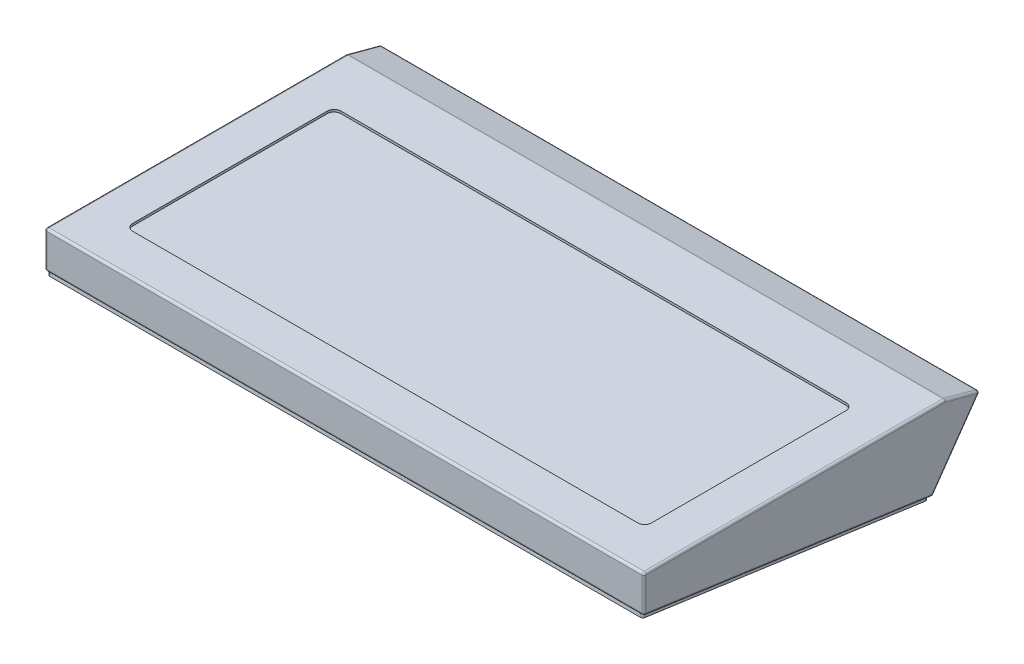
SolidWorks part; units mm, degrees
ref_plane "Front Plane" through (0, 0, 0) normal (0, 0, 1) x (1, 0, 0)
ref_plane "Top Plane" through (0, 0, 0) normal (0, 1, 0) x (1, 0, 0)
ref_plane "Right Plane" through (0, 0, 0) normal (1, 0, 0) x (0, 0, -1)
sketch "Sketch2" plane through (0, 0, 0) normal (1, 0, 0) x (0, 0, -1)
  line L1 (0, 0) -> (-209.55, 0)
  line L2 (-209.55, 0) -> (-209.55, -25.654)
  line L4 (-8.6004, -53.8956) -> (-209.55, -25.654)
  line L5 (0, 0) -> (24.5345, -6.574)
  line L6 (24.5345, -6.574) -> (-8.6004, -53.8956)
  dimension "D1" = 98
  dimension "D2" = 209.55
  dimension "D3" = 15
  dimension "D4" = 25.654
  dimension "D5" = 90
  dimension "D6" = 63
  dimension "D7" = 25.4
extrude "Enclosure Body" add sketch "Sketch2" along normal mid plane 416.56
fillet "Radii" radius 1.524 15 edges at (208.28, 0, 104.775) (0, 0, 209.55) (-208.28, 0, 104.775) (-208.28, -39.7748, 109.0752) (0, -25.654, 209.55) (208.28, -39.7748, 109.0752) (0, 0, 0) (208.28, -30.2348, -7.967) (208.28, -12.827, 209.55) (0, -6.574, -24.5345) (208.28, -3.287, -12.2673) (-208.28, -3.287, -12.2673) (-208.28, -12.827, 209.55) (0, -53.8956, 8.6004) (-208.28, -30.2348, -7.967)
sketch "Sketch3" plane through (0, 0, 0) normal (0, 1, 0) x (1, 0, 0)
  line L1 (-175.5648, -36.322) -> (175.5648, -36.322)
  line L2 (-180.34, -41.0972) -> (-180.34, -176.3268)
  line L3 (-175.5648, -181.102) -> (175.5648, -181.102)
  line L4 (180.34, -41.0972) -> (180.34, -176.3268)
  line L5 (206.756, -209.55) -> (-206.756, -209.55) construction
  arc A0 (-180.34, -176.3268) -> (-175.5648, -181.102) centre (-175.5648, -176.3268) ccw
  arc A1 (175.5648, -181.102) -> (180.34, -176.3268) centre (175.5648, -176.3268) ccw
  arc A2 (175.5648, -36.322) -> (180.34, -41.0972) centre (175.5648, -41.0972) cw
  arc A3 (-175.5648, -36.322) -> (-180.34, -41.0972) centre (-175.5648, -41.0972) ccw
  point P4 (0, -36.322)
  point P10 (-180.34, -181.102)
  point P13 (180.34, -181.102)
  point P18 (-180.34, -36.322)
  dimension "D4" = 4.7752
  dimension "D1" = 360.68
  dimension "D2" = 144.78
  dimension "D3" = 28.448
extrude "Keys Extrude" cut sketch "Sketch3" against normal blind 1.6002
sketch "Sketch4" plane through (0, -54.037, 7.5944) normal (0, -0.9903, 0.1392) x (1, 0, 0)
  line L7 (-205.232, 203.1087) -> (205.232, 203.1087)
  line L8 (206.756, 201.5847) -> (206.756, 4.4807)
  line L9 (205.232, 2.9567) -> (-205.232, 2.9567)
  line L10 (-206.756, 4.4807) -> (-206.756, 201.5847)
  line L11 (-208.28, 1.9498) -> (-208.28, 202.6155) construction
  line L12 (208.28, 202.6155) -> (208.28, 1.9498) construction
  line L13 (-206.756, 204.1247) -> (206.756, 204.1247) construction
  arc A4 (-206.756, 4.4807) -> (-205.232, 2.9567) centre (-205.232, 4.4807) ccw
  arc A5 (206.756, 4.4807) -> (205.232, 2.9567) centre (205.232, 4.4807) cw
  arc A6 (206.756, 201.5847) -> (205.232, 203.1087) centre (205.232, 201.5847) ccw
  arc A7 (-205.232, 203.1087) -> (-206.756, 201.5847) centre (-205.232, 201.5847) ccw
  dimension "D3" = 1.524
  dimension "D1" = 1.524
  dimension "D2" = 1.524
  dimension "D4" = 1.016
  dimension "D5" = 200.152
  dimension "D7" = 413.512
extrude "Sub-panel Emboss" add sketch "Sketch4" along normal blind 2.286
sketch "Sketch11" plane through (0, -56.3008, 7.9126) normal (0, -0.9903, 0.1392) x (1, 0, 0)
  line L0 (-206.756, 201.5847) -> (-206.756, 4.4807) construction
  circle A0 centre (0, 103.0327) radius 9.525
  point P9 (-206.756, 103.0327)
  dimension "D1" = 19.05
extrude "Gore Vent" add sketch "Sketch11" along normal blind 6.35
sketch "Sketch13" plane through (0, -95.1288, 37.4722) normal (0, 0.5736, 0.8192) x (-1, 0, 0)
  line L1 (-206.756, -105.929) -> (-206.756, -51.2704) construction
  circle A0 centre (0, -78.5997) radius 8.382
  point P6 (-206.756, -78.5997)
  dimension "D1" = 16.764
extrude "Cable Seal and Strain Relief" add sketch "Sketch13" against normal blind 53.975
draft "Draft2" type of draft neutral plane draft angle 3 faces to draft 1 parameters "D1"=3
fillet "Fillet1" radius 1.524 1 edges at (0, -66.2515, -48.6392)
sketch "Sketch14" plane through (0, -44.649, -63.7654) normal (0, -0.5736, -0.8192) x (1, 0, 0)
  circle A0 centre (0, 20.8185) radius 2.4765
  dimension "D1" = 4.953
extrude "Cable Depiction" add sketch "Sketch14" along normal blind 53.975
hole_wizard "Tap Drill for M6x1.0 Tap1" positions "Sketch15" profile "Sketch16" hole size "M6x1.0" standard "ANSI Metric"
sketch "Sketch15" plane through (0, -13.6902, -19.5517) normal (0, -0.5736, -0.8192) x (-1, 0, 0)
  line L0 (-177.8, -2.4797) -> (177.8, -2.4797) construction
  line L1 (177.8, -2.4797) -> (-177.8, -2.4797) construction
  line L3 (-177.8, -2.4797) -> (-177.8, -39.1573) construction
  line L5 (-206.756, 6.5108) -> (-206.756, -48.1478) construction
  point P0 (-177.8, -2.4797)
  point P2 (-177.8, -39.1573)
  point P4 (177.8, -39.1573)
  point P6 (177.8, -2.4797)
  point P15 (0, -2.4797)
  point P26 (-177.8, -20.8185)
  point P29 (-206.756, -20.8185)
  dimension "D1" = 36.6776
  dimension "D2" = 355.6
sketch "Sketch16" plane through (177.8, -15.7215, -18.1294) normal (1, 0, 0) x (0, 0.8192, -0.5736)
  line L0 (0, 0) -> (0, 24.3622)
  line L1 (0, 24.3622) -> (2.5, 22.86)
  line L2 (2.5, 22.86) -> (2.5, 0)
  line L5 (2.5, 0) -> (0, 0)
  line L10 (0, 24.3622) -> (-2.5, 22.86) construction
  line L11 (0, -6.35) -> (0, 107.95) construction
  dimension "Hole Dia." = 5
  dimension "Hole Depth" = 22.86
  dimension "Drill Angle" = 118
